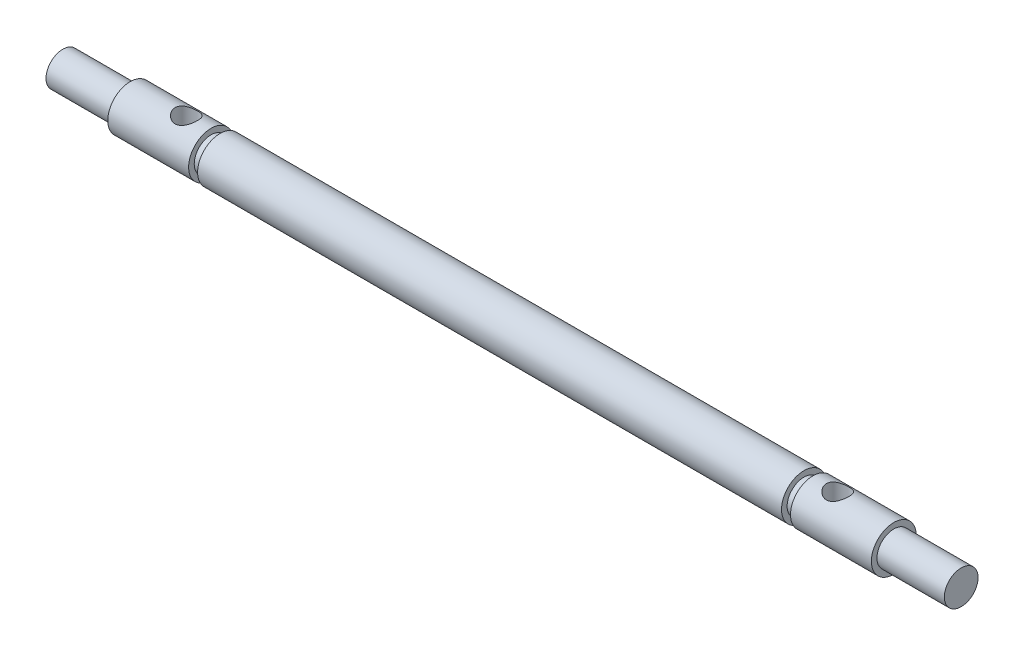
SolidWorks part; units mm, degrees
ref_plane "正面" through (0, 0, 0) normal (0, 0, 1) x (1, 0, 0)
ref_plane "平面" through (0, 0, 0) normal (0, 1, 0) x (1, 0, 0)
ref_plane "右側面" through (0, 0, 0) normal (1, 0, 0) x (0, 0, -1)
sketch "ｽｹｯﾁ1" plane through (0, 0, 0) normal (0, 1, 0) x (1, 0, 0)
  line L0 (26.8, 2) -> (34, 2)
  line L1 (0, 2) -> (26, 2)
  line L2 (0, 2) -> (0, 0)
  line L3 (0, 0) -> (40, 0)
  line L4 (40, 1.5) -> (40, 0)
  line L6 (34, 2) -> (34, 1.5)
  line L7 (34, 1.5) -> (40, 1.5)
  line L10 (26, 2) -> (26, 1.5)
  line L11 (26, 1.5) -> (26.8, 1.5)
  line L12 (26.8, 2) -> (26.8, 1.5)
  dimension "D1" = 40
  dimension "D2" = 2
  dimension "D3" = 26
  dimension "D4" = 0.8
  dimension "D5" = 0.5
  dimension "D6" = 6
revolve "回転1" add sketch "ｽｹｯﾁ1" angle 360 about L3
sketch "ｽｹｯﾁ2" plane through (0, 0, 0) normal (0, 1, 0) x (1, 0, 0)
  circle A0 centre (29, 0) radius 1
  dimension "D1" = 2
  dimension "D2" = 29
extrude "ｶｯﾄ - 押し出し1" cut sketch "ｽｹｯﾁ2" against normal through all and the other way through all
mirror "ﾐﾗｰ1" about plane through (0, 0, 0) normal (1, 0, 0) of "ｶｯﾄ - 押し出し1", "回転1"
